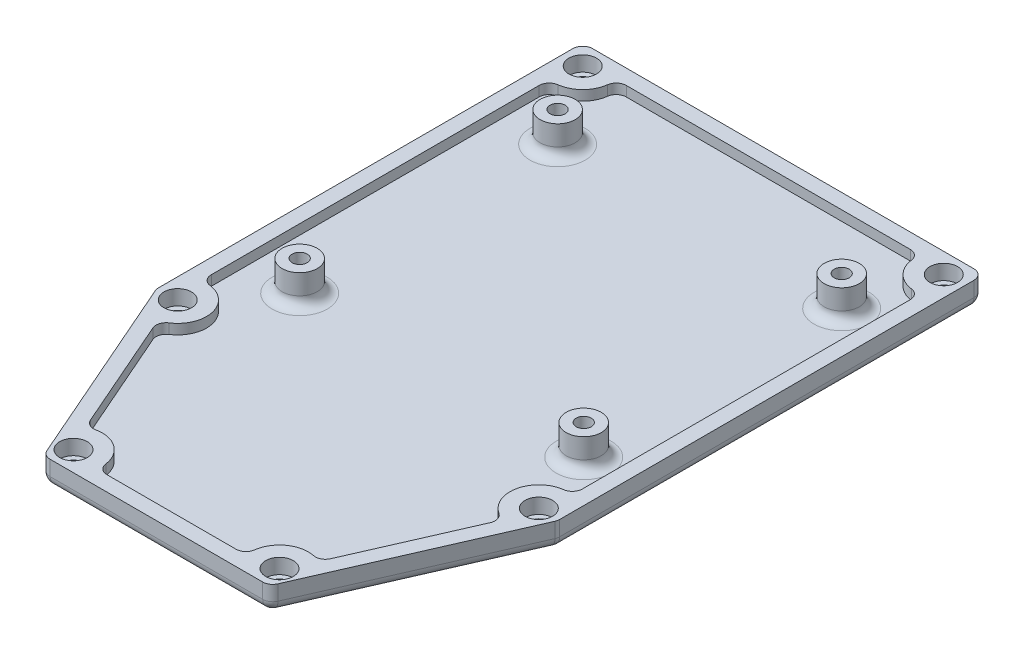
SolidWorks part; units mm, degrees
ref_plane "Front Plane" through (0, 0, 0) normal (0, 0, 1) x (1, 0, 0)
ref_plane "Top Plane" through (0, 0, 0) normal (0, 1, 0) x (1, 0, 0)
ref_plane "Right Plane" through (0, 0, 0) normal (1, 0, 0) x (0, 0, -1)
sketch "Sketch1" plane through (0, 0, 0) normal (0, 1, 0) x (1, 0, 0)
  line L0 (-45.9688, 40.0312) -> (34.0312, 40.0312)
  line L1 (34.0312, 40.0312) -> (34.0313, -44.9688)
  line L2 (-45.9688, 40.0312) -> (-45.9687, -44.9688)
  line L3 (-28.4687, -84.9688) -> (16.5313, -84.9688)
  line L4 (16.5313, -84.9688) -> (34.0313, -44.9688)
  line L5 (-28.4687, -84.9688) -> (-45.9687, -44.9688)
  dimension "D1" = 80
  dimension "D2" = 85
  dimension "D3" = 85
  dimension "D4" = 45
  dimension "D5" = 17.5
  dimension "D6" = 125
extrude "Boss-Extrude1" add sketch "Sketch1" along normal blind 5
sketch "Sketch2" plane through (0, 5, 0) normal (0, 1, 0) x (1, 0, 0)
  line L0 (34.0312, 40.0312) -> (-45.9688, 40.0312) construction
  line L1 (-45.9687, -44.9688) -> (-28.4687, -84.9688) construction
  line L2 (34.0313, -44.9688) -> (34.0312, 40.0312) construction
  line L3 (-45.9688, 40.0312) -> (-45.9687, -44.9688) construction
  line L4 (-28.4687, -84.9688) -> (16.5313, -84.9688) construction
  point P0 (-42.9688, 37.0312)
  point P1 (31.0313, 37.0312)
  point P2 (31.0313, -44.7188)
  point P3 (14.5733, -81.9688)
  point P4 (-26.5067, -81.9688)
  point P5 (-42.9688, -44.7188)
  dimension "D1" = 3
  dimension "D2" = 3
  dimension "D3" = 3
  dimension "D4" = 41.08
  dimension "D5" = 81.75
  dimension "D6" = 3
  dimension "D8" = 3
hole_wizard "CBORE for M3 SHCS1" positions "Sketch3" profile "Sketch4" counterbore size "M3" standard "ANSI Metric"
sketch "Sketch3" plane through (0, 5, 0) normal (0, 1, 0) x (1, 0, 0)
  line L1 (34.0313, -44.9688) -> (34.0312, 40.0312) construction
  line L2 (-45.9688, 40.0312) -> (-45.9687, -44.9688) construction
  line L3 (34.0312, 40.0312) -> (-45.9688, 40.0312) construction
  line L4 (-28.4687, -84.9688) -> (16.5313, -84.9688) construction
  point P0 (-41.9688, 36.0312)
  point P3 (30.0313, 36.0312)
  point P6 (30.0313, -44.7188)
  point P9 (14.5733, -80.9688)
  point P12 (-26.5067, -80.9688)
  point P15 (-41.9688, -44.7188)
  dimension "D1" = 4
  dimension "D2" = 4
  dimension "D3" = 4
  dimension "D4" = 4
  dimension "D5" = 4
  dimension "D6" = 4
  dimension "D7" = 4
  dimension "D8" = 4
sketch "Sketch4" plane through (-41.9688, 5, -36.0312) normal (1, 0, 0) x (0, 0, 1)
  line L0 (0, 0) -> (0, 5)
  line L1 (0, 5) -> (1.7, 5)
  line L3 (1.7, 5) -> (1.7, 3)
  line L4 (1.7, 3) -> (2.75, 3)
  line L5 (2.75, 3) -> (2.75, 0)
  line L7 (2.75, 0) -> (0, 0)
  line L11 (0, -6.35) -> (0, 107.95) construction
  dimension "Thru Hole Dia." = 3.4
  dimension "Thru Hole Depth" = 5
  dimension "C'Bore Dia." = 5.5
  dimension "C'Bore Depth" = 3
fillet "Fillet1" radius 2 6 edges at (-45.9687, 0, 2.4688) (-37.2187, 0, 64.9688) (-5.9687, 0, 84.9688) (25.2813, 0, 64.9688) (34.0313, 0, 2.4688) (-5.9688, 0, -40.0312)
fillet "Fillet2" radius 2 12 edges at (-45.383, 0.5858, -39.4455) (-28.0856, 0.5858, 84.383) (-45.383, 0.5858, 44.8462) (-45.9688, 3.5, -40.0312) (-28.4687, 3.5, 84.9688) (-45.9687, 3.5, 44.9688) (16.1481, 0.5858, 84.383) (33.4455, 0.5858, 44.8462) (33.4455, 0.5858, -39.4455) (16.5313, 3.5, 84.9688) (34.0313, 3.5, 44.9688) (34.0312, 3.5, -40.0312)
shell "Shell1" thickness 3
fillet "Fillet3" radius 2 12 edges at (-40.3852, 4, 50.2464) (-42.9687, 4, 39.0564) (-42.9688, 4, -30.3689) (31.0313, 4, 39.0564) (28.4477, 4, 50.2464) (31.0312, 4, -30.3689) (8.9109, 4, 81.9688) (17.2363, 4, 75.8726) (-20.8443, 4, 81.9688) (-29.173, 4, 75.8743) (-36.3064, 4, -37.0312) (24.3689, 4, -37.0312)
sketch "Sketch7" plane through (0, 3, 0) normal (0, 1, 0) x (1, 0, 0)
  line L0 (22.346, 37.0312) -> (-34.2835, 37.0312) construction
  line L1 (-42.9687, -37.0335) -> (-42.9687, 28.346) construction
  line L2 (22.346, 37.0312) -> (-34.2835, 37.0312) construction
  circle A0 centre (-32.9687, 22.0312) radius 1.5
  circle A1 centre (-32.9687, 22.0312) radius 3.5
  circle A2 centre (23.6733, 22.0312) radius 1.5
  circle A3 centre (23.6733, 22.0312) radius 3.5
  circle A4 centre (-32.9687, -29.4038) radius 1.5
  circle A5 centre (-32.9687, -29.4038) radius 3.5
  circle A6 centre (23.6732, -29.4088) radius 1.5
  circle A7 centre (23.6732, -29.4088) radius 3.5
  dimension "D1" = 56.642
  dimension "D6" = 3
  dimension "D7" = 7
  dimension "D8" = 7
  dimension "D9" = 3
  dimension "D10" = 3
  dimension "D11" = 7
  dimension "D12" = 3
  dimension "D13" = 7
  dimension "D2" = 51.435
  dimension "D3" = 15
  dimension "D4" = 51.44
  dimension "D5" = 56.642
  dimension "D14" = 10
  dimension "D15" = 15
extrude "Boss-Extrude2" add sketch "Sketch7" along normal blind 6
fillet "Fillet4" radius 2 4 edges at (23.6732, 3, 32.9088) (-32.9687, 3, -18.5312) (23.6733, 3, -18.5312) (-32.9687, 3, 32.9038)
